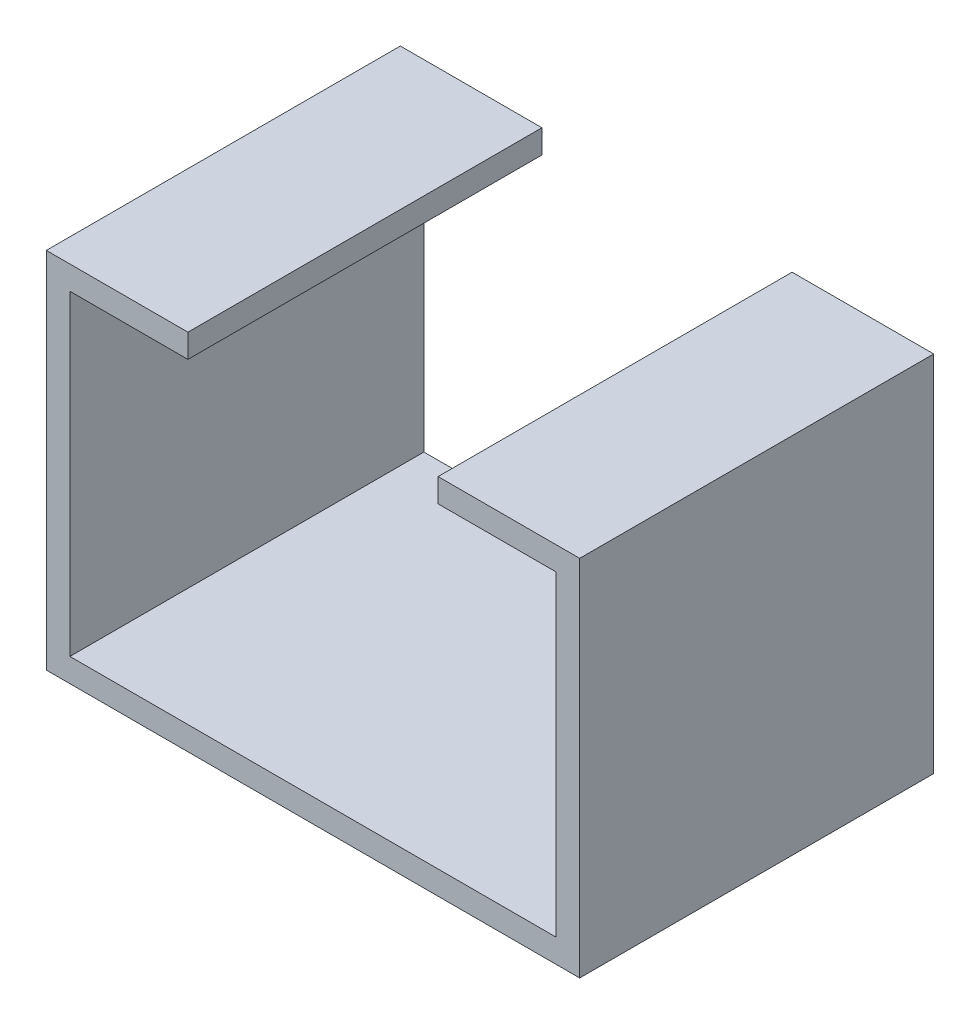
SolidWorks part; units mm, degrees
ref_plane "Front" through (0, 0, 0) normal (0, 0, 1) x (1, 0, 0)
ref_plane "Top" through (0, 0, 0) normal (0, 1, 0) x (1, 0, 0)
ref_plane "Right" through (0, 0, 0) normal (1, 0, 0) x (0, 0, -1)
sketch "Sketch1" plane through (0, 0, 0) normal (0, 0, 1) x (1, 0, 0)
  line L0 (0, 0) -> (20.6, 0)
  line L1 (20.6, 0) -> (20.6, 13.4)
  line L2 (20.6, 13.4) -> (15.6, 13.4)
  line L3 (0, 0) -> (0, 13.4)
  line L4 (0, 13.4) -> (5, 13.4)
  line L5 (-1, 14.4) -> (5, 14.4)
  line L6 (-1, -1) -> (-1, 14.4)
  line L7 (-1, -1) -> (21.6, -1)
  line L8 (21.6, -1) -> (21.6, 14.4)
  line L9 (21.6, 14.4) -> (15.6, 14.4)
  line L10 (15.6, 14.4) -> (15.6, 13.4)
  line L11 (5, 14.4) -> (5, 13.4)
extrude "Extrude1" add sketch "Sketch1" along normal blind 15
